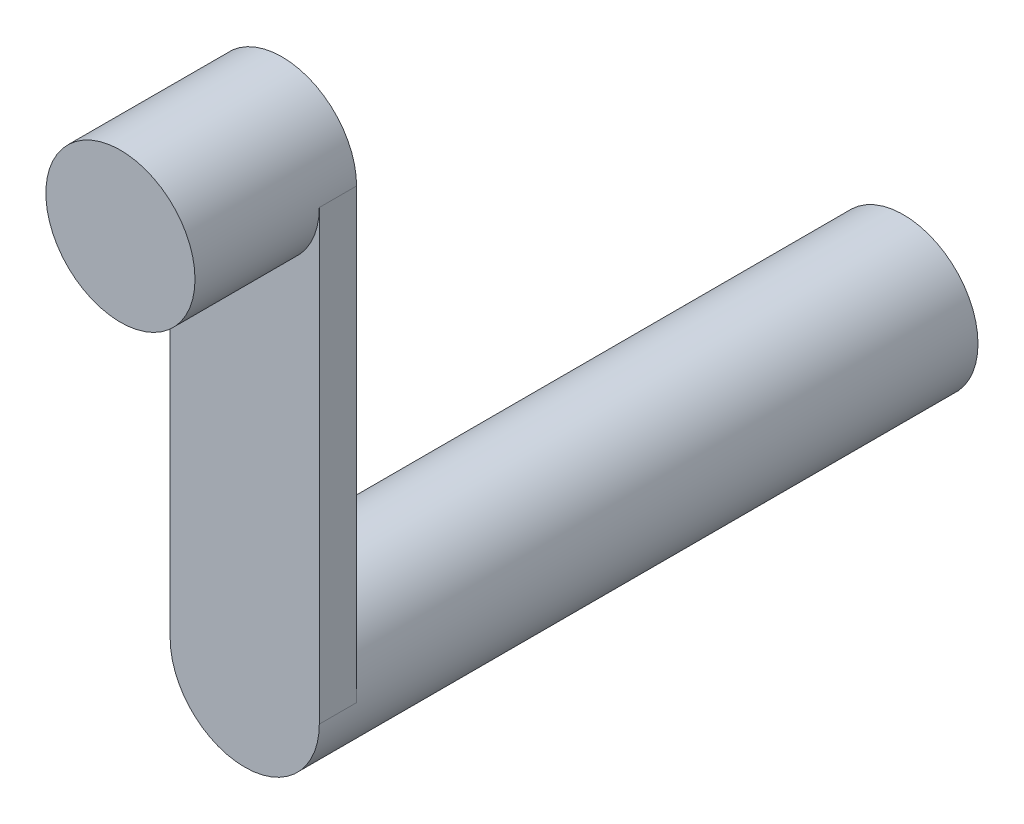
SolidWorks part; units mm, degrees
ref_plane "Face" through (0, 0, 0) normal (0, 0, 1) x (1, 0, 0)
ref_plane "Dessus" through (0, 0, 0) normal (0, 1, 0) x (1, 0, 0)
ref_plane "Droite" through (0, 0, 0) normal (1, 0, 0) x (0, 0, -1)
sketch "Esquisse1" plane through (0, 0, 0) normal (0, 0, 1) x (1, 0, 0)
  circle A0 centre (0, 0) radius 6
extrude "Extrusion1" add sketch "Esquisse1" along normal blind 50
sketch "Esquisse2" plane through (0, 0, 50) normal (0, 0, 1) x (1, 0, 0)
  line L0 (-6, 36) -> (-6, 0)
  line L1 (6, 36) -> (6, 0)
  arc A0 (-6, 0) -> (6, 0) centre (0, 0) ccw
  arc A1 (6, 36) -> (-6, 36) centre (0, 36) ccw
  dimension "D1" = 36
extrude "Extrusion2" add sketch "Esquisse2" along normal blind 3
sketch "Esquisse3" plane through (0, 0, 53) normal (0, 0, 1) x (1, 0, 0)
  circle A0 centre (0, 36) radius 6
extrude "Extrusion3" add sketch "Esquisse3" along normal blind 10
